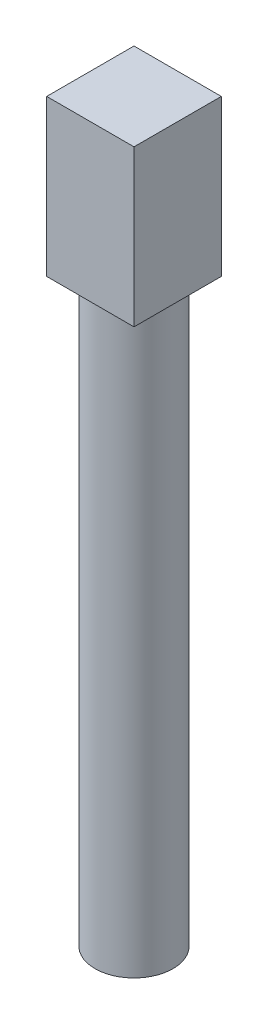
SolidWorks part; units mm, degrees
ref_plane "Front Plane" through (0, 0, 0) normal (0, 0, 1) x (1, 0, 0)
ref_plane "Top Plane" through (0, 0, 0) normal (0, 1, 0) x (1, 0, 0)
ref_plane "Right Plane" through (0, 0, 0) normal (1, 0, 0) x (0, 0, -1)
sketch "Sketch1" plane through (0, 0, 0) normal (0, 1, 0) x (1, 0, 0)
  circle A0 centre (0, 0) radius 1.5875
  dimension "D1" = 3.175
extrude "Boss-Extrude1" add sketch "Sketch1" along normal blind 23.622
sketch "Sketch2" plane through (0, 23.622, 0) normal (0, 1, 0) x (1, 0, 0)
  line L1 (-1.778, 1.778) -> (1.778, 1.778)
  line L2 (-1.778, 1.778) -> (-1.778, -1.778)
  line L3 (-1.778, -1.778) -> (1.778, -1.778)
  line L4 (1.778, 1.778) -> (1.778, -1.778)
  line L5 (-1.778, 1.778) -> (1.778, -1.778) construction
  line L6 (-1.778, -1.778) -> (1.778, 1.778) construction
  point P0 (0, 0)
  dimension "D1" = 3.556
  dimension "D2" = 3.556
extrude "Boss-Extrude2" add sketch "Sketch2" along normal blind 6.35
